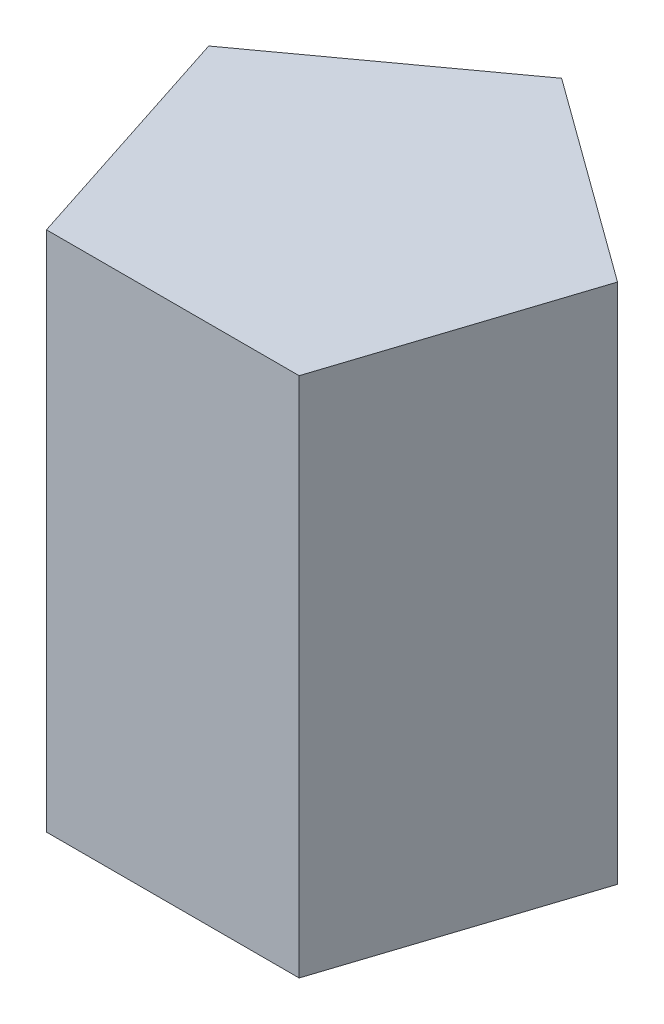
SolidWorks part; units mm, degrees
ref_plane "前视基准面" through (0, 0, 0) normal (0, 0, 1) x (1, 0, 0)
ref_plane "上视基准面" through (0, 0, 0) normal (0, 1, 0) x (1, 0, 0)
ref_plane "右视基准面" through (0, 0, 0) normal (1, 0, 0) x (0, 0, -1)
sketch "草图1" plane through (0, 0, 0) normal (0, 1, 0) x (1, 0, 0)
  line L1 (0, 24.7214) -> (-23.5114, 7.6393)
  line L2 (-23.5114, 7.6393) -> (-14.5309, -20)
  line L3 (-14.5309, -20) -> (14.5309, -20)
  line L4 (14.5309, -20) -> (23.5114, 7.6393)
  line L5 (23.5114, 7.6393) -> (0, 24.7214)
  circle A0 centre (0, 0) radius 20 construction
  dimension "D1" = 40
extrude "凸台-拉伸4" add sketch "草图1" along normal blind 60
